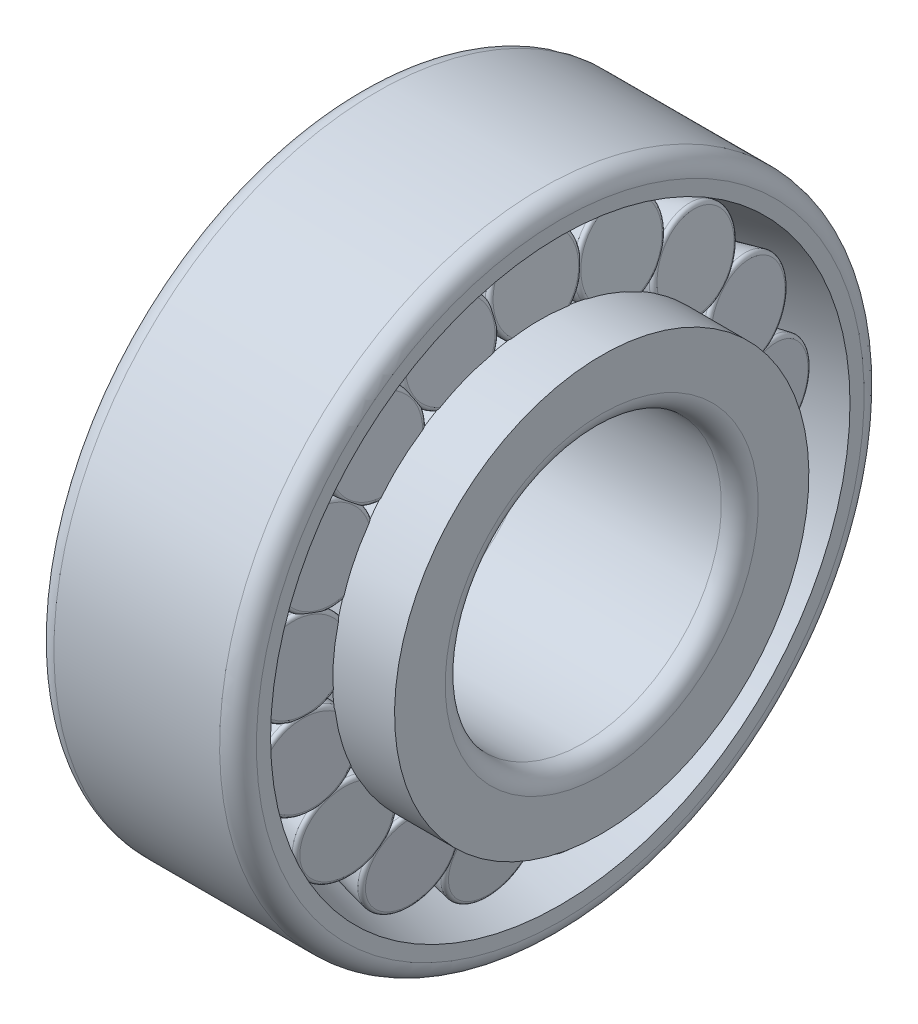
SolidWorks part; units mm, degrees
ref_plane "Front" through (0, 0, 0) normal (0, 0, 1) x (1, 0, 0)
ref_plane "Top" through (0, 0, 0) normal (0, 1, 0) x (1, 0, 0)
ref_plane "Right" through (0, 0, 0) normal (1, 0, 0) x (0, 0, -1)
sketch "Sketch1" plane through (0, 0, 0) normal (0, 0, 1) x (1, 0, 0)
  line L0 (7.75, 0) -> (13.9916, 0) construction
  line L1 (5.5, 15.734) -> (5.5, 16.5)
  line L2 (4.5, 17.5) -> (-4.5, 17.5)
  line L3 (-5.5, 16.5) -> (-5.5, 13.204)
  line L4 (-5.5, 13.204) -> (5.5, 15.734)
  line L5 (-4.25, 8.5) -> (-4.25, 11.5021)
  line L6 (-3.25, 7.5) -> (6.75, 7.5)
  line L7 (7.75, 8.5) -> (7.75, 13.393)
  line L8 (-3.0787, 10.0021) -> (-3.5875, 13.6439)
  line L9 (4.5, 10.393) -> (3.8082, 15.3449)
  line L10 (-3.3331, 11.823) -> (4.1541, 12.869) construction
  line L11 (-3.0787, 10.0021) -> (4.5, 10.393)
  line L12 (4.0809, 11.25) -> (7.75, 11.25)
  line L13 (7.75, 13.393) -> (4.0809, 13.393)
  line L14 (-4.25, 11.5021) -> (-3.2883, 11.5021)
  arc A0 (-4.5, 17.5) -> (-5.5, 16.5) centre (-4.5, 16.5) ccw
  arc A1 (5.5, 16.5) -> (4.5, 17.5) centre (4.5, 16.5) ccw
  arc A2 (-3.25, 7.5) -> (-4.25, 8.5) centre (-3.25, 8.5) cw
  arc A3 (6.75, 7.5) -> (7.75, 8.5) centre (6.75, 8.5) ccw
  point P19 (-5.5, 17.5)
  point P22 (5.5, 17.5)
  point P24 (0, 17.5)
  point P29 (-4.25, 7.5)
  point P32 (7.75, 7.5)
  dimension "XR12" = 1
  dimension "XR34" = 1
  dimension "D1" = 11.3375
  dimension "DD" = 35
  dimension "D2" = 3.25
  dimension "DT" = 13.25
  dimension "D3" = 3
  dimension "D4" = 1.5
  dimension "DC" = 11
  dimension "D5" = 6.25
  dimension "D6" = 4.296
  dimension "XD" = 15
  dimension "D7" = 5
  dimension "gzzj" = 5
  dimension "DB" = 12
  dimension "XALF" = 12.953
revolve "Revolve1" add sketch "Sketch1" angle 360 about L0
sketch "Sketch2" plane through (0, 0, 0) normal (0, 0, 1) x (1, 0, 0)
  line L0 (-3.3529, 11.8202) -> (11.0852, 13.8373) construction
  line L4 (-3.3331, 11.823) -> (4.1541, 12.869) construction
  line L5 (-3.3529, 11.8202) -> (4.1739, 12.8717)
  line L7 (-3.6073, 13.6411) -> (-3.096, 9.9811)
  line L8 (4.5228, 10.3742) -> (3.828, 15.3477)
  line L9 (-3.096, 9.9811) -> (4.5228, 10.3742)
  line L10 (-3.3529, 11.8202) -> (-3.1214, 10.1627)
  line L11 (4.4926, 10.5903) -> (4.1739, 12.8717)
  line L12 (-2.913, 9.9906) -> (4.3049, 10.3629)
  arc A0 (-2.913, 9.9906) -> (-3.1214, 10.1627) centre (-2.9233, 10.1903) cw
  arc A1 (4.3049, 10.3629) -> (4.4926, 10.5903) centre (4.2946, 10.5627) ccw
  dimension "D2" = 0.2
  dimension "D1" = 0.02
revolve "Revolve2" add sketch "Sketch2" angle 360 about L0
sketch "Sketch3" plane through (0, 0, 0) normal (0, 0, 1) x (1, 0, 0)
  line L0 (-5.5, 13.204) -> (5.5, 15.734) construction
  line L1 (-5.5, 16.5) -> (-5.5, 13.204) construction
  line L2 (4.5, 17.5) -> (-4.5, 17.5) construction
  line L3 (5.5, 15.734) -> (5.5, 16.5) construction
  line L4 (-5.5, 13.204) -> (5.5, 15.734)
  line L5 (-5.5, 16.5) -> (-5.5, 13.204)
  line L6 (4.5, 17.5) -> (-4.5, 17.5)
  line L7 (5.5, 15.734) -> (5.5, 16.5)
  arc A0 (-4.5, 17.5) -> (-5.5, 16.5) centre (-4.5, 16.5) ccw construction
  arc A1 (5.5, 16.5) -> (4.5, 17.5) centre (4.5, 16.5) ccw construction
  arc A2 (-4.5, 17.5) -> (-5.5, 16.5) centre (-4.5, 16.5) ccw
  arc A3 (5.5, 16.5) -> (4.5, 17.5) centre (4.5, 16.5) ccw
revolve "Revolve3" add sketch "Sketch3" angle 360 about axis through (7.75, 0, 0) along (1, 0, 0)
pattern_circular "Circular-Pattern1" count 17 over 360 about axis through (0, 0, 0) along (1, 0, 0) of "Revolve2"
